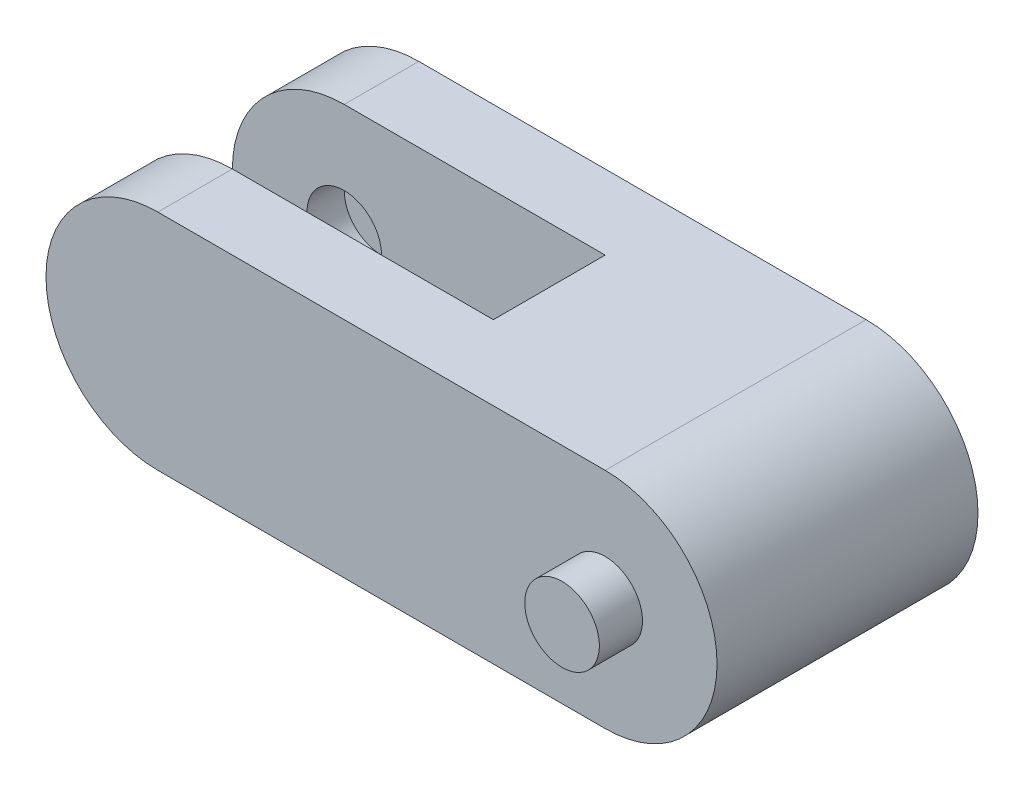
SolidWorks part; units mm, degrees
ref_plane "Front Plane" through (0, 0, 0) normal (0, 0, 1) x (1, 0, 0)
ref_plane "Top Plane" through (0, 0, 0) normal (0, 1, 0) x (1, 0, 0)
ref_plane "Right Plane" through (0, 0, 0) normal (1, 0, 0) x (0, 0, -1)
sketch "Sketch2" plane through (0, 0, 0) normal (0, 0, 1) x (1, 0, 0)
  line L0 (-76.2, 38.1) -> (76.2, 38.1)
  line L2 (-76.2, -38.1) -> (76.2, -38.1)
  line L3 (0, 38.1) -> (0, -38.1) construction
  line L4 (-114.3, 0) -> (114.3, 0) construction
  arc A0 (76.2, 38.1) -> (76.2, -38.1) centre (76.2, 0) cw
  arc A1 (-76.2, 38.1) -> (-76.2, -38.1) centre (-76.2, 0) ccw
  point P10 (0, 0)
  dimension "D1" = 152.4
  dimension "D2" = 76.2
extrude "Boss-Extrude1" add sketch "Sketch2" along normal mid plane 88.9
sketch "Sketch3" plane through (0, 0, -44.45) normal (0, 0, -1) x (-1, 0, 0)
  circle A0 centre (-76.2, 0) radius 12.7
  dimension "D1" = 25.4
extrude "Boss-Extrude2" add sketch "Sketch3" along normal blind 14.7
mirror "Mirror1" about plane through (0, 0, 0) normal (0, 0, 1) of "Boss-Extrude2"
sketch "Sketch5" plane through (0, 0, 0) normal (0, 0, 1) x (1, 0, 0)
  line L0 (-76.2, 38.1) -> (12.7, 38.1)
  line L3 (76.2, 38.1) -> (-76.2, 38.1) construction
  line L4 (12.7, 38.1) -> (12.7, -38.1)
  line L5 (-76.2, -38.1) -> (76.2, -38.1) construction
  line L6 (12.7, -38.1) -> (-76.2, -38.1)
  arc A3 (-76.2, 38.1) -> (-76.2, -38.1) centre (-76.2, 0) ccw construction
  arc A4 (-76.2, 38.1) -> (-76.2, -38.1) centre (-76.2, 0) ccw
  dimension "D1" = 88.9
extrude "Cut-Extrude1" cut sketch "Sketch5" against normal mid plane 38.1
sketch "Sketch7" plane through (0, 0, -19.05) normal (0, 0, 1) x (1, 0, 0)
  circle A0 centre (-76.2, 0) radius 12.7
  dimension "D1" = 25.4
extrude "Cut-Extrude2" cut sketch "Sketch7" against normal blind 12.7
mirror "Mirror2" about plane through (0, 0, 0) normal (0, 0, 1) of "Cut-Extrude2"
